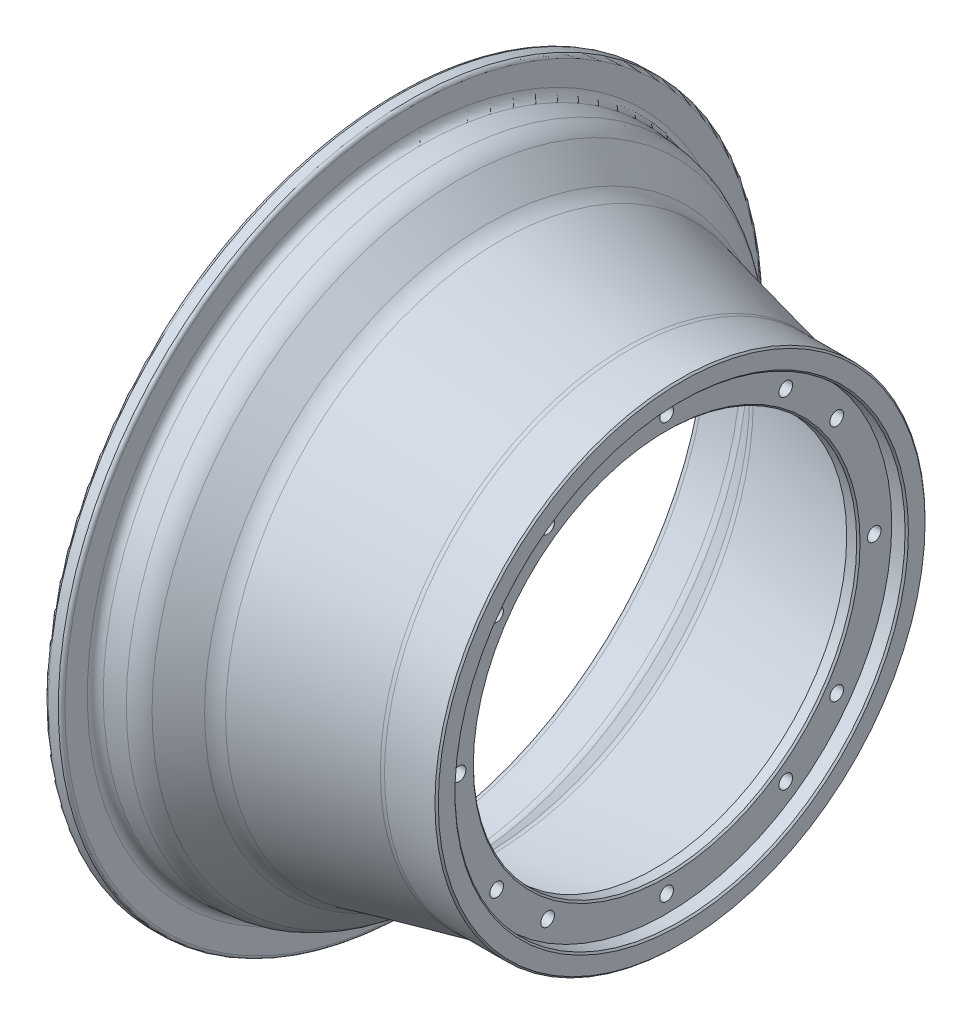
SolidWorks part; units mm, degrees
ref_plane "Front Plane" through (0, 0, 0) normal (0, 0, 1) x (1, 0, 0)
ref_plane "Top Plane" through (0, 0, 0) normal (0, 1, 0) x (1, 0, 0)
ref_plane "Right Plane" through (0, 0, 0) normal (1, 0, 0) x (0, 0, -1)
sketch "Sketch1" plane through (0, 0, 0) normal (0, 0, 1) x (1, 0, 0)
  line L0 (0, 0) -> (-293.2198, 0) construction
  line L1 (0, 135) -> (-9, 135)
  line L2 (-9, 135) -> (-9, 115)
  line L3 (0, 135) -> (0, 147)
  line L4 (-9, 115) -> (-16, 115)
  line L5 (-16, 115) -> (-16, 135)
  line L6 (-16, 135) -> (-117.4761, 158.4276)
  line L7 (-117.4761, 158.4276) -> (-141.4, 180.7197)
  line L8 (-141.4, 180.7197) -> (-171.4, 183.3443)
  line L9 (-171.4, 183.3443) -> (-171.4, 210.5)
  line L10 (-171.4, 210.5) -> (-161.4, 210.5)
  line L11 (-161.4, 210.5) -> (-161.4, 190.5)
  line L12 (-161.4, 190.5) -> (-137.9603, 188.4493)
  line L13 (-137.9603, 188.4493) -> (-113.5895, 165.7407)
  line L14 (-113.5895, 165.7407) -> (-32.4144, 147)
  line L15 (-32.4144, 147) -> (0, 147)
  dimension "D1" = 270
  dimension "D2" = 230
  dimension "D3" = 9
  dimension "D4" = 7
  dimension "D5" = 20
  dimension "D6" = 152.4
  dimension "D7" = 10
  dimension "D8" = 8
  dimension "D9" = 8
  dimension "D10" = 8
  dimension "D11" = 12
  dimension "D12" = 381
  dimension "D13" = 20
  dimension "D15" = 103
  dimension "D16" = 95
  dimension "D17" = 30
revolve "Revolve1" add sketch "Sketch1" angle 360 about L0
sketch "Sketch2" plane through (-16, 0, 0) normal (-1, 0, 0) x (0, 0, 1)
  line L0 (0, 124.5) -> (0, 0) construction
  line L1 (0, 0) -> (71.4103, 101.9844) construction
  line L2 (0, 0) -> (101.9844, 71.4103) construction
  line L3 (0, 0) -> (88.0348, 88.0348) construction
  line L4 (71.4103, 101.9844) -> (101.9844, 71.4103) construction
  circle A0 centre (0, 124.5) radius 4.1
  circle A1 centre (71.4103, 101.9844) radius 4.1
  circle A2 centre (101.9844, 71.4103) radius 4.1
  circle A3 centre (0, 0) radius 124.5 construction
  point P10 (86.6973, 86.6973)
  dimension "D1" = 249
  dimension "D2" = 8.2
  dimension "D3" = 20
  dimension "D4" = 45
extrude "Cut-Extrude1" cut sketch "Sketch2" against normal blind 10
pattern_circular "CirPattern1" count 4 over 360 about axis through (0, 0, 0) along (1, 0, 0) of "Cut-Extrude1"
fillet "Fillet1" radius 10 2 edges at (-141.4, 0, -180.7197) (-117.4761, 0, -158.4276)
fillet "Fillet2" radius 18 2 edges at (-137.9603, 0, -188.4493) (-113.5895, 0, -165.7407)
fillet "Fillet3" radius 10 1 edges at (-32.4144, 0, -147)
chamfer "Chamfer1" distance 1 angle 45 3 edges at (-9, 0, -115) (0, 0, -135) (0, 0, -147)
fillet "Fillet4" radius 2 1 edges at (-16, 0, -135)
fillet "Fillet5" radius 5 2 edges at (-171.4, 0, -183.3443) (-161.4, 0, -190.5)
fillet "Fillet6" radius 2 2 edges at (-161.4, 0, -210.5) (-171.4, 0, -210.5)
sketch "Sketch3" plane through (0, 0, 0) normal (0, 0, 1) x (1, 0, 0)
  line L0 (-138.8824, 178.3738) -> (-119.4349, 160.2528)
  line L1 (-119.4349, -160.2528) -> (-138.8824, -178.3738)
  line L2 (-119.4349, -160.2528) -> (-138.8824, -178.3738)
  line L3 (-138.8824, 178.3738) -> (-119.4349, 160.2528)
  line L4 (-129.1587, -169.3133) -> (-136.2778, -161.6731) construction
ref_plane "Plane1" through (-136.2778, -161.6731, 0) normal (-0.6817, 0.7316, 0) x (0.7316, 0.6817, 0)
sketch "Sketch4" plane through (-136.2778, -161.6731, 0) normal (-0.6817, 0.7316, 0) x (0.7316, 0.6817, 0)
  circle A0 centre (0, 0) radius 6
  dimension "D1" = 12
extrude "Cut-Extrude2" cut sketch "Sketch4" against normal blind 28
